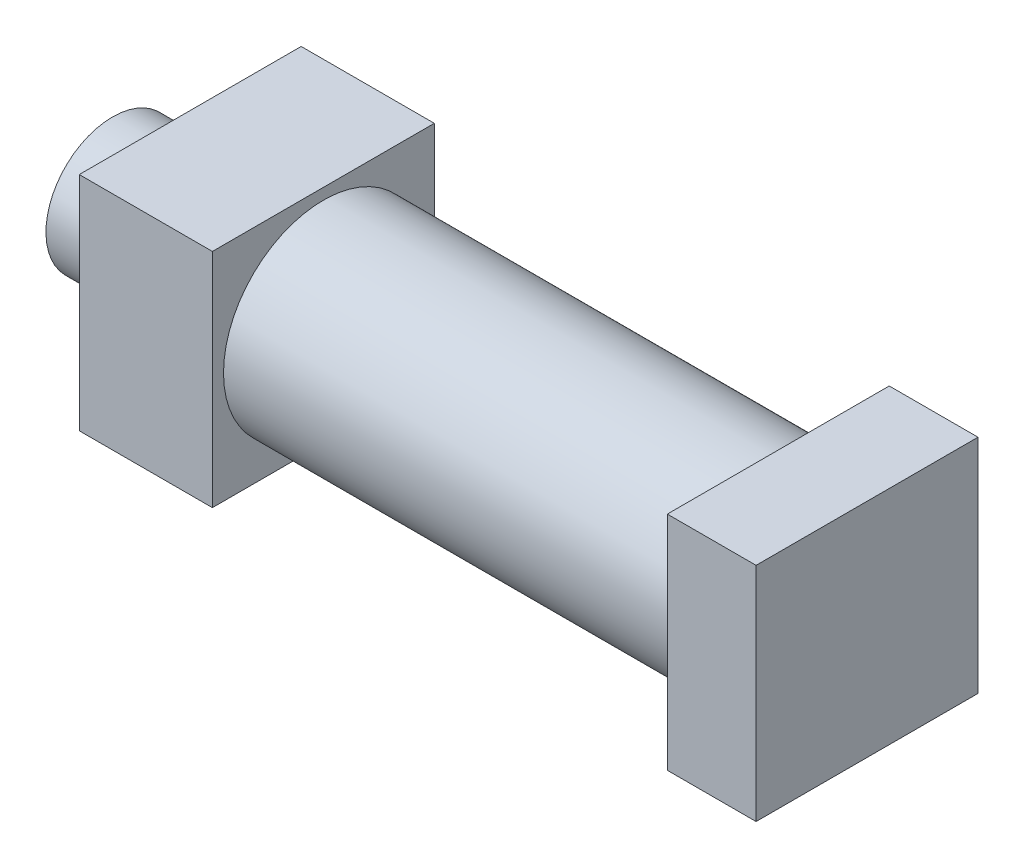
SolidWorks part; units mm, degrees
ref_plane "front" through (0, 0, 0) normal (0, 0, 1) x (1, 0, 0)
ref_plane "top" through (0, 0, 0) normal (0, 1, 0) x (1, 0, 0)
ref_plane "side" through (0, 0, 0) normal (1, 0, 0) x (0, 0, -1)
sketch "Sketch1" plane through (0, 0, 0) normal (1, 0, 0) x (0, 0, -1)
  line L0 (-31.75, 31.75) -> (31.75, 31.75)
  line L1 (-31.75, 31.75) -> (-31.75, -31.75)
  line L2 (31.75, -31.75) -> (-31.75, -31.75)
  line L3 (31.75, -31.75) -> (31.75, 31.75)
  line L4 (0, 31.75) -> (0, 0) construction
  line L5 (31.75, 0) -> (0, 0) construction
  dimension "E" = 63.5
extrude "Base-Extrude" add sketch "Sketch1" against normal blind 25.4
sketch "STROKE" plane through (0, 0, 0) normal (0, 0, 1) x (1, 0, 0)
  line L0 (0, 0) -> (-101.6, 0) construction
  line L1 (-101.6, 0) -> (-193.675, 0) construction
  dimension "STROKE" = 101.6
  dimension "LB" = 92.075
ref_plane "LB + STROKE" through (-193.675, 0, 0) normal (-1, 0, 0) x (0, 0, 1)
sketch "Sketch2" plane through (0, 0, 0) normal (-1, 0, 0) x (0, 0, 1)
  line L0 (0, 0) -> (28.575, 0) construction
  circle A0 centre (0, 0) radius 28.575
  circle A1 centre (0, 0) radius 25.4
  point P5 (25.4, 0)
  dimension "D1" = 3.175
  dimension "BORE" = 50.8
extrude "BORE" add sketch "Sketch2" along normal up to surface (193.675 mm away)
sketch "Sketch3" plane through (-193.675, 0, 0) normal (-1, 0, 0) x (0, 0, 1)
  line L2 (31.75, 31.75) -> (-31.75, 31.75)
  line L3 (31.75, 31.75) -> (-31.75, 31.75)
  line L4 (31.75, -31.75) -> (31.75, 31.75)
  line L7 (-31.75, 31.75) -> (-31.75, -31.75)
  line L8 (31.75, -31.75) -> (31.75, 31.75)
  line L9 (-31.75, 31.75) -> (-31.75, -31.75)
  line L10 (-31.75, -31.75) -> (31.75, -31.75)
  line L11 (-31.75, -31.75) -> (31.75, -31.75)
  dimension "D1" = 0
extrude "Boss-Extrude2" add sketch "Sketch3" against normal blind 38.1
sketch "Sketch4" plane through (-193.675, 0, 0) normal (1, 0, 0) x (0, 0, -1)
  circle A0 centre (0, 0) radius 19.05
  dimension "B" = 38.1
extrude "Boss-Extrude3" add sketch "Sketch4" against normal blind 22.225
sketch "Sketch5" plane through (-215.9, 0, 0) normal (-1, 0, 0) x (0, 0, 1)
  circle A0 centre (0, 0) radius 12.7
  dimension "MM_ROD_DIA" = 25.4
extrude "Cut-Extrude1" cut sketch "Sketch5" against normal up to surface (190.5 mm away)
sketch "Sketch6" plane through (148.5418, -31.75, 0.8139) normal (0, -1, 0) x (1, 0, 0)
  line L0 (-161.2418, 30.9361) -> (-161.2418, -11.9264) construction
  line L1 (-323.1668, 30.9361) -> (-323.1668, -32.5639) construction
  line L2 (-173.9418, -0.8139) -> (-138.5475, -0.8139) construction
  line L3 (-304.1168, 30.9361) -> (-342.2168, 30.9361) construction
  line L4 (-173.9418, -32.5639) -> (-173.9418, 30.9361) construction
  line L5 (-173.9418, 30.9361) -> (-148.5418, 30.9361) construction
  line L6 (-304.1168, -32.5639) -> (-342.2168, -32.5639) construction
  line L7 (-161.2418, -11.9264) -> (-323.1668, -11.9264) construction
  circle A0 centre (-161.2418, 10.2986) radius 3.9687
  circle A2 centre (-161.2418, -11.9264) radius 3.9687
  circle A3 centre (-323.1668, -11.9264) radius 3.9687
  circle A4 centre (-323.1668, 10.2986) radius 3.9687
  dimension "D1" = 22.225
  dimension "RD" = 7.9375
extrude "TAPPED BASE HOLES - MS4" cut sketch "Sketch6" against normal blind 19.05
sketch "Sketch10" plane through (0, 0, 0) normal (0, 0, 1) x (1, 0, 0)
  line L0 (-174.625, 31.75) -> (-174.625, -31.75) construction
  line L1 (-155.575, 31.75) -> (-193.675, 31.75) construction
  line L2 (-155.575, -31.75) -> (-193.675, -31.75) construction
  circle A0 centre (-174.625, 0) radius 12.7
  dimension "TD" = 25.4
extrude "HEAD TRUNION - MT1" add sketch "Sketch10" along normal mid plane 114.3
sketch "Sketch11" plane through (0, 0, 0) normal (0, 0, 1) x (1, 0, 0)
  line L0 (0, 0) -> (29.8231, 0) construction
  line L1 (-155.575, 0) -> (-215.9, 0) construction
  line L2 (31.75, -9.525) -> (31.75, 9.525)
  line L3 (31.75, 9.525) -> (0, 21.0811)
  line L4 (0, 31.75) -> (0, -31.75) construction
  line L5 (0, 21.0811) -> (0, -21.0811)
  line L6 (31.75, -9.525) -> (0, -21.0811)
  circle A0 centre (19.05, 0) radius 15.875 construction
  circle A1 centre (19.05, 0) radius 6.3627
  point P10 (0, 0)
  point P12 (31.75, 0)
  dimension "MR" = 15.875
  dimension "CD" = 12.7254
  dimension "D2" = 70
  dimension "L" = 19.05
  dimension "M" = 12.7
extrude "CAP EYE - MP3" add sketch "Sketch11" along normal mid plane 19.05
